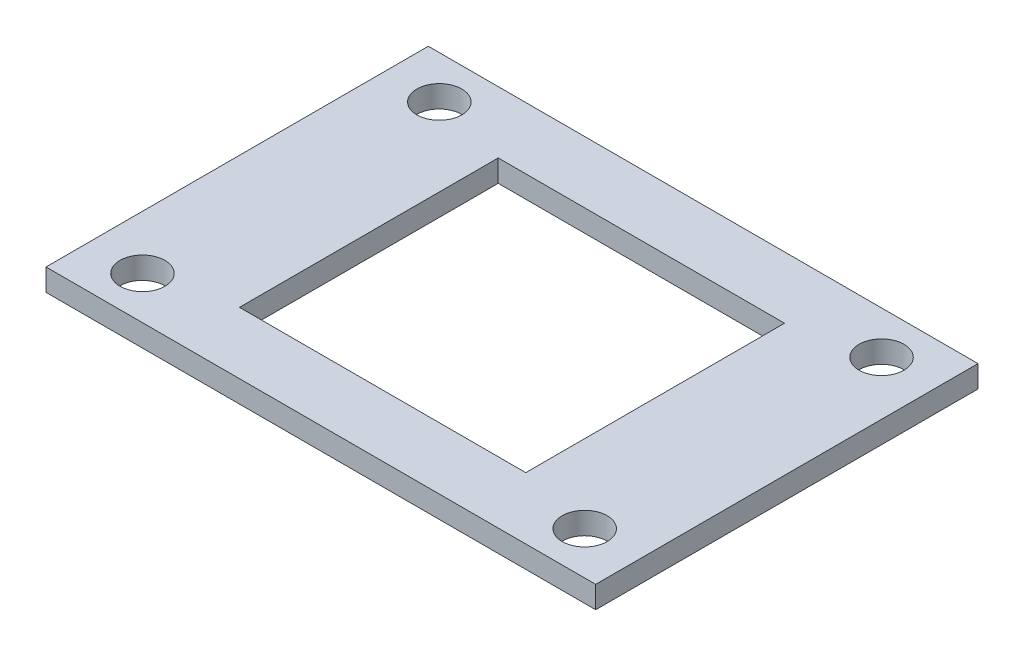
SolidWorks part; units mm, degrees
ref_plane "Front Plane" through (0, 0, 0) normal (0, 0, 1) x (1, 0, 0)
ref_plane "Top Plane" through (0, 0, 0) normal (0, 1, 0) x (1, 0, 0)
ref_plane "Right Plane" through (0, 0, 0) normal (1, 0, 0) x (0, 0, -1)
sketch "Sketch1" plane through (0, 0, 0) normal (0, 1, 0) x (1, 0, 0)
  line L1 (0, 0) -> (24.96, 0)
  line L2 (0, 0) -> (0, -17.36)
  line L3 (0, -17.36) -> (24.96, -17.36)
  line L4 (24.96, 0) -> (24.96, -17.36)
  dimension "D1" = 24.96
  dimension "D2" = 17.36
extrude "Boss-Extrude1" add sketch "Sketch1" against normal blind 1
sketch "Sketch2" plane through (0, 0, 0) normal (0, 1, 0) x (1, 0, 0)
  line L1 (5.98, -2.805) -> (18.98, -2.805)
  line L2 (5.98, -2.805) -> (5.98, -14.555)
  line L3 (5.98, -14.555) -> (18.98, -14.555)
  line L4 (18.98, -2.805) -> (18.98, -14.555)
  line L5 (24.96, -17.36) -> (24.96, 0) construction
  line L6 (24.96, 0) -> (0, 0) construction
  dimension "D1" = 13
  dimension "D2" = 11.75
  dimension "D3" = 5.98
  dimension "D4" = 2.805
extrude "Cut-Extrude1" cut sketch "Sketch2" against normal through all
sketch "Sketch3" plane through (0, 0, 0) normal (0, 1, 0) x (1, 0, 0)
  line L0 (24.96, -17.36) -> (24.96, 0) construction
  line L1 (24.96, 0) -> (0, 0) construction
  line L2 (0, 0) -> (0, -17.36) construction
  line L3 (0, -17.36) -> (24.96, -17.36) construction
  circle A0 centre (2.44, -1.94) radius 1.02
  circle A1 centre (22.52, -1.94) radius 1.02
  circle A2 centre (22.52, -15.42) radius 1.02
  circle A3 centre (2.44, -15.42) radius 1.02
  dimension "D1" = 2.04
  dimension "D2" = 2.04
  dimension "D3" = 2.04
  dimension "D4" = 2.04
  dimension "D5" = 2.44
  dimension "D6" = 1.94
  dimension "D7" = 1.94
  dimension "D8" = 2.44
  dimension "D9" = 2.44
  dimension "D10" = 1.94
  dimension "D11" = 2.44
  dimension "D12" = 1.94
extrude "Cut-Extrude2" cut sketch "Sketch3" against normal through all
